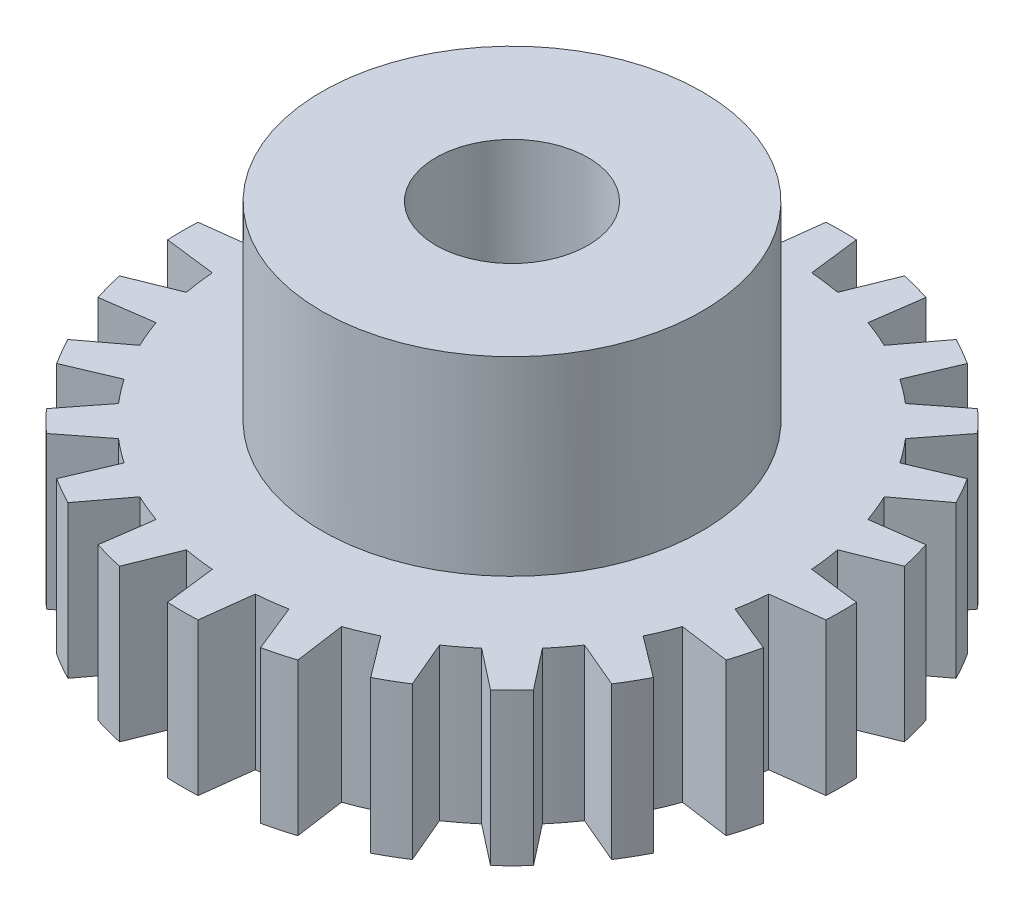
SolidWorks part; units mm, degrees
ref_plane "Front Plane" through (0, 0, 0) normal (0, 0, 1) x (1, 0, 0)
ref_plane "Top Plane" through (0, 0, 0) normal (0, 1, 0) x (1, 0, 0)
ref_plane "Right Plane" through (0, 0, 0) normal (1, 0, 0) x (0, 0, -1)
sketch "Sketch1" plane through (0, 0, 0) normal (0, 1, 0) x (1, 0, 0)
  line L96 (-0.635, 13.7394) -> (-0.8963, 11.6114)
  line L97 (0.635, 13.7394) -> (0.8963, 11.6114)
  line L98 (0, 13.7541) -> (0, 0) construction
  line L99 (4.1694, 13.1069) -> (3.871, 10.9837)
  line L100 (2.9427, 13.4356) -> (2.1395, 11.4477)
  line L101 (7.4196, 11.5812) -> (6.5819, 9.6076)
  line L102 (6.3198, 12.2162) -> (5.0295, 10.5039)
  line L103 (10.1643, 9.2662) -> (8.8442, 7.5767)
  line L104 (9.2662, 10.1643) -> (7.5767, 8.8442)
  line L105 (12.2162, 6.3198) -> (10.5039, 5.0295)
  line L107 (11.5812, 7.4196) -> (9.6076, 6.5819)
  line L108 (13.4356, 2.9427) -> (11.4477, 2.1395)
  line L109 (13.1069, 4.1694) -> (10.9837, 3.871)
  line L110 (13.7394, -0.635) -> (11.6114, -0.8963)
  line L111 (13.7394, 0.635) -> (11.6114, 0.8963)
  line L112 (13.1069, -4.1694) -> (10.9837, -3.871)
  line L113 (13.4356, -2.9427) -> (11.4477, -2.1395)
  line L114 (11.5812, -7.4196) -> (9.6076, -6.5819)
  line L115 (12.2162, -6.3198) -> (10.5039, -5.0295)
  line L116 (9.2662, -10.1643) -> (7.5767, -8.8442)
  line L117 (10.1643, -9.2662) -> (8.8442, -7.5767)
  line L118 (6.3198, -12.2162) -> (5.0295, -10.5039)
  line L119 (7.4196, -11.5812) -> (6.5819, -9.6076)
  line L120 (2.9427, -13.4356) -> (2.1395, -11.4477)
  line L121 (4.1694, -13.1069) -> (3.871, -10.9837)
  line L122 (-0.635, -13.7394) -> (-0.8963, -11.6114)
  line L123 (0.635, -13.7394) -> (0.8963, -11.6114)
  line L124 (-4.1694, -13.1069) -> (-3.871, -10.9837)
  line L125 (-2.9427, -13.4356) -> (-2.1395, -11.4477)
  line L126 (-7.4196, -11.5812) -> (-6.5819, -9.6076)
  line L127 (-6.3198, -12.2162) -> (-5.0295, -10.5039)
  line L128 (-10.1643, -9.2662) -> (-8.8442, -7.5767)
  line L129 (-9.2662, -10.1643) -> (-7.5767, -8.8442)
  line L131 (-12.2162, -6.3198) -> (-10.5039, -5.0295)
  line L132 (-11.5812, -7.4196) -> (-9.6076, -6.5819)
  line L133 (-13.4356, -2.9427) -> (-11.4477, -2.1395)
  line L134 (-13.1069, -4.1694) -> (-10.9837, -3.871)
  line L135 (-13.7394, 0.635) -> (-11.6114, 0.8963)
  line L136 (-13.7394, -0.635) -> (-11.6114, -0.8963)
  line L137 (-13.1069, 4.1694) -> (-10.9837, 3.871)
  line L138 (-13.4356, 2.9427) -> (-11.4477, 2.1395)
  line L139 (-11.5812, 7.4196) -> (-9.6076, 6.5819)
  line L140 (-12.2162, 6.3198) -> (-10.5039, 5.0295)
  line L141 (-9.2662, 10.1643) -> (-7.5767, 8.8442)
  line L142 (-10.1643, 9.2662) -> (-8.8442, 7.5767)
  line L143 (-6.3198, 12.2162) -> (-5.0295, 10.5039)
  line L144 (-7.4196, 11.5812) -> (-6.5819, 9.6076)
  line L145 (-2.9427, 13.4356) -> (-2.1395, 11.4477)
  line L146 (-4.1694, 13.1069) -> (-3.871, 10.9837)
  circle A0 centre (0, 0) radius 12.7 construction
  circle A1 centre (0, 0) radius 13.7541 construction
  circle A2 centre (0, 0) radius 11.6459 construction
  circle A27 centre (0, 0) radius 3.175
  arc A76 (-0.635, 13.7394) -> (0.635, 13.7394) centre (0, 0) cw
  arc A77 (2.9427, 13.4356) -> (4.1694, 13.1069) centre (0, 0) cw
  arc A78 (6.3198, 12.2162) -> (7.4196, 11.5812) centre (0, 0) cw
  arc A79 (9.2662, 10.1643) -> (10.1643, 9.2662) centre (0, 0) cw
  arc A80 (11.5812, 7.4196) -> (12.2162, 6.3198) centre (0, 0) cw
  arc A81 (13.1069, 4.1694) -> (13.4356, 2.9427) centre (0, 0) cw
  arc A82 (13.7394, 0.635) -> (13.7394, -0.635) centre (0, 0) cw
  arc A83 (13.4356, -2.9427) -> (13.1069, -4.1694) centre (0, 0) cw
  arc A84 (12.2162, -6.3198) -> (11.5812, -7.4196) centre (0, 0) cw
  arc A85 (10.1643, -9.2662) -> (9.2662, -10.1643) centre (0, 0) cw
  arc A86 (7.4196, -11.5812) -> (6.3198, -12.2162) centre (0, 0) cw
  arc A87 (4.1694, -13.1069) -> (2.9427, -13.4356) centre (0, 0) cw
  arc A88 (0.635, -13.7394) -> (-0.635, -13.7394) centre (0, 0) cw
  arc A89 (-2.9427, -13.4356) -> (-4.1694, -13.1069) centre (0, 0) cw
  arc A90 (-6.3198, -12.2162) -> (-7.4196, -11.5812) centre (0, 0) cw
  arc A91 (-9.2662, -10.1643) -> (-10.1643, -9.2662) centre (0, 0) cw
  arc A92 (-11.5812, -7.4196) -> (-12.2162, -6.3198) centre (0, 0) cw
  arc A93 (-13.1069, -4.1694) -> (-13.4356, -2.9427) centre (0, 0) cw
  arc A94 (-13.7394, -0.635) -> (-13.7394, 0.635) centre (0, 0) cw
  arc A95 (-13.4356, 2.9427) -> (-13.1069, 4.1694) centre (0, 0) cw
  arc A96 (-12.2162, 6.3198) -> (-11.5812, 7.4196) centre (0, 0) cw
  arc A97 (-10.1643, 9.2662) -> (-9.2662, 10.1643) centre (0, 0) cw
  arc A98 (-7.4196, 11.5812) -> (-6.3198, 12.2162) centre (0, 0) cw
  arc A99 (-4.1694, 13.1069) -> (-2.9427, 13.4356) centre (0, 0) cw
  arc A101 (0.8963, 11.6114) -> (2.1395, 11.4477) centre (0, 0) cw
  arc A102 (3.871, 10.9837) -> (5.0295, 10.5039) centre (0, 0) cw
  arc A103 (6.5819, 9.6076) -> (7.5767, 8.8442) centre (0, 0) cw
  arc A104 (8.8442, 7.5767) -> (9.6076, 6.5819) centre (0, 0) cw
  arc A105 (10.5039, 5.0295) -> (10.9837, 3.871) centre (0, 0) cw
  arc A106 (11.4477, 2.1395) -> (11.6114, 0.8963) centre (0, 0) cw
  arc A107 (11.6114, -0.8963) -> (11.4477, -2.1395) centre (0, 0) cw
  arc A108 (10.9837, -3.871) -> (10.5039, -5.0295) centre (0, 0) cw
  arc A109 (9.6076, -6.5819) -> (8.8442, -7.5767) centre (0, 0) cw
  arc A111 (7.5767, -8.8442) -> (6.5819, -9.6076) centre (0, 0) cw
  arc A112 (5.0295, -10.5039) -> (3.871, -10.9837) centre (0, 0) cw
  arc A113 (2.1395, -11.4477) -> (0.8963, -11.6114) centre (0, 0) cw
  arc A115 (-0.8963, -11.6114) -> (-2.1395, -11.4477) centre (0, 0) cw
  arc A116 (-3.871, -10.9837) -> (-5.0295, -10.5039) centre (0, 0) cw
  arc A117 (-6.5819, -9.6076) -> (-7.5767, -8.8442) centre (0, 0) cw
  arc A118 (-8.8442, -7.5767) -> (-9.6076, -6.5819) centre (0, 0) cw
  arc A119 (-10.5039, -5.0295) -> (-10.9837, -3.871) centre (0, 0) cw
  arc A120 (-11.4477, -2.1395) -> (-11.6114, -0.8963) centre (0, 0) cw
  arc A121 (-11.6114, 0.8963) -> (-11.4477, 2.1395) centre (0, 0) cw
  arc A122 (-10.9837, 3.871) -> (-10.5039, 5.0295) centre (0, 0) cw
  arc A123 (-9.6076, 6.5819) -> (-8.8442, 7.5767) centre (0, 0) cw
  arc A124 (-7.5767, 8.8442) -> (-6.5819, 9.6076) centre (0, 0) cw
  arc A125 (-5.0295, 10.5039) -> (-3.871, 10.9837) centre (0, 0) cw
  arc A126 (-2.1395, 11.4477) -> (-0.8963, 11.6114) centre (0, 0) cw
  point P57 (0, 0)
  point P108 (0, 0)
  point P132 (0, 0)
  point P157 (0, 0)
  point P161 (0, 0)
  point P193 (0, 0)
extrude "Boss-Extrude1" add sketch "Sketch1" along normal blind 6.35
sketch "Sketch2" plane through (0, 6.35, 0) normal (0, 1, 0) x (1, 0, 0)
  circle A0 centre (0, 0) radius 3.175
  circle A1 centre (0, 0) radius 7.9375
extrude "Boss-Extrude2" add sketch "Sketch2" along normal blind 7.9375
equation "\"Pitch-Diam\"= 1"
equation "\"Outer-Diam\"= 1.083"
equation "\"Inner-Diam\"= \"Pitch-Diam\" - ( \"Outer-Diam\" - \"Pitch-Diam\" )"
equation "\"Teeth\"= 24"
equation "\"Bore\"= 1 / 4"
equation "\"Hub-Proj\"= 5 / 16"
equation "\"Face-Width\"= 1 / 4"
equation "\"Hub-Diam\"= 5 / 8"
equation "\"D2@Sketch1\"=\"Outer-Diam\""
equation "\"D5@Sketch1\"=\"Bore\""
equation "\"D1@Sketch2\"=\"Hub-Diam\""
equation "\"D1@Boss-Extrude2\"=\"Hub-Proj\""
equation "\"D1@Boss-Extrude1\"=\"Face-Width\""
equation "\"D7@Sketch1\"= \"Teeth\""
equation "\"D2@Sketch2\"=\"Bore\""
equation "\"D6@Sketch1\"= \"Teeth\""
equation "\"D1@Sketch1\"=\"Pitch-Diam\""
equation "\"D3@Sketch1\"=\"Inner-Diam\""
